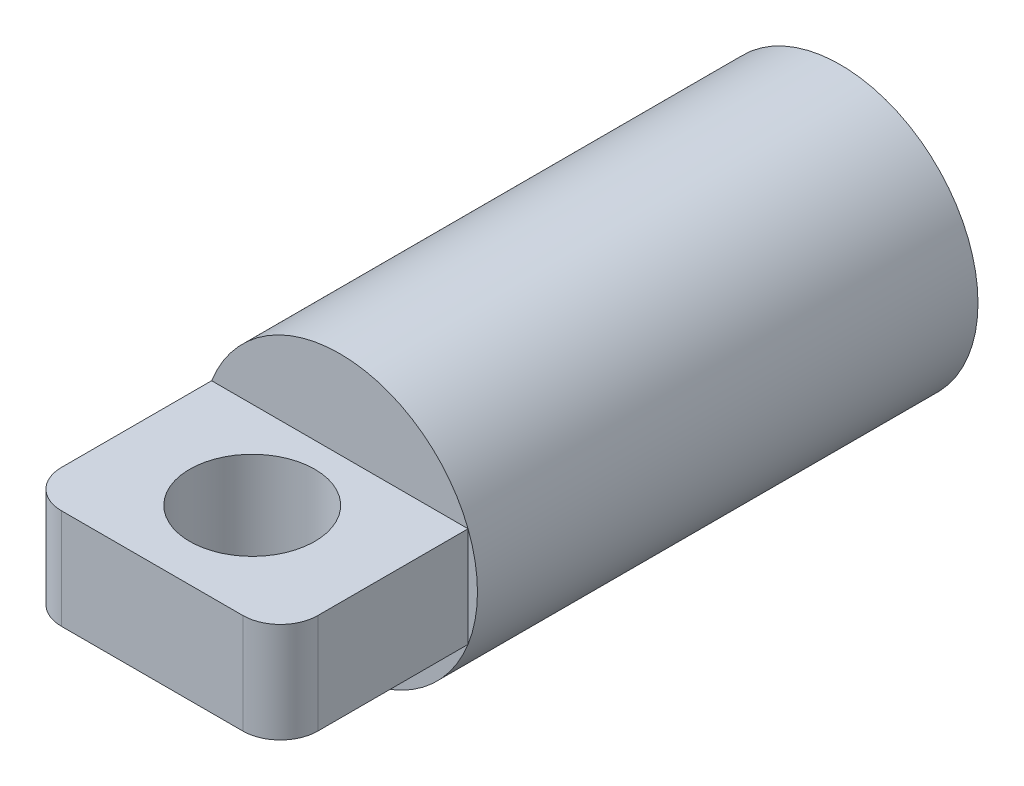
SolidWorks part; units mm, degrees
ref_plane "Front Plane" through (0, 0, 0) normal (0, 0, 1) x (1, 0, 0)
ref_plane "Top Plane" through (0, 0, 0) normal (0, 1, 0) x (1, 0, 0)
ref_plane "Right Plane" through (0, 0, 0) normal (1, 0, 0) x (0, 0, -1)
sketch "Sketch1" plane through (0, 0, 0) normal (0, 0, 1) x (1, 0, 0)
  circle A0 centre (0, 0) radius 11
  dimension "D1" = 22
extrude "Boss-Extrude1" add sketch "Sketch1" along normal blind 55
sketch "Sketch2" plane through (0, 0, 55) normal (0, 0, 1) x (1, 0, 0)
  line L1 (-10.247, -4) -> (10.247, -4)
  line L2 (-10.247, -4) -> (-10.247, 4)
  line L3 (-10.247, 4) -> (10.247, 4)
  line L4 (10.247, -4) -> (10.247, 4)
  line L5 (-10.247, -4) -> (10.247, 4) construction
  line L6 (-10.247, 4) -> (10.247, -4) construction
  circle A4 centre (0, 0) radius 11 construction
  point P0 (0, 0)
  dimension "D1" = 8
extrude "Cut-Extrude1" cut sketch "Sketch2" against normal blind 15 flip side to cut
fillet "Fillet2" radius 3 2 edges at (10.247, 0, 55) (-10.247, 0, 55)
sketch "Sketch4" plane through (0, -4, 0) normal (0, -1, 0) x (1, 0, 0)
  line L0 (-10.247, 52) -> (0, 52) construction
  circle A0 centre (0, 47) radius 5
  dimension "D1" = 10
extrude "Cut-Extrude2" cut sketch "Sketch4" against normal blind 8
